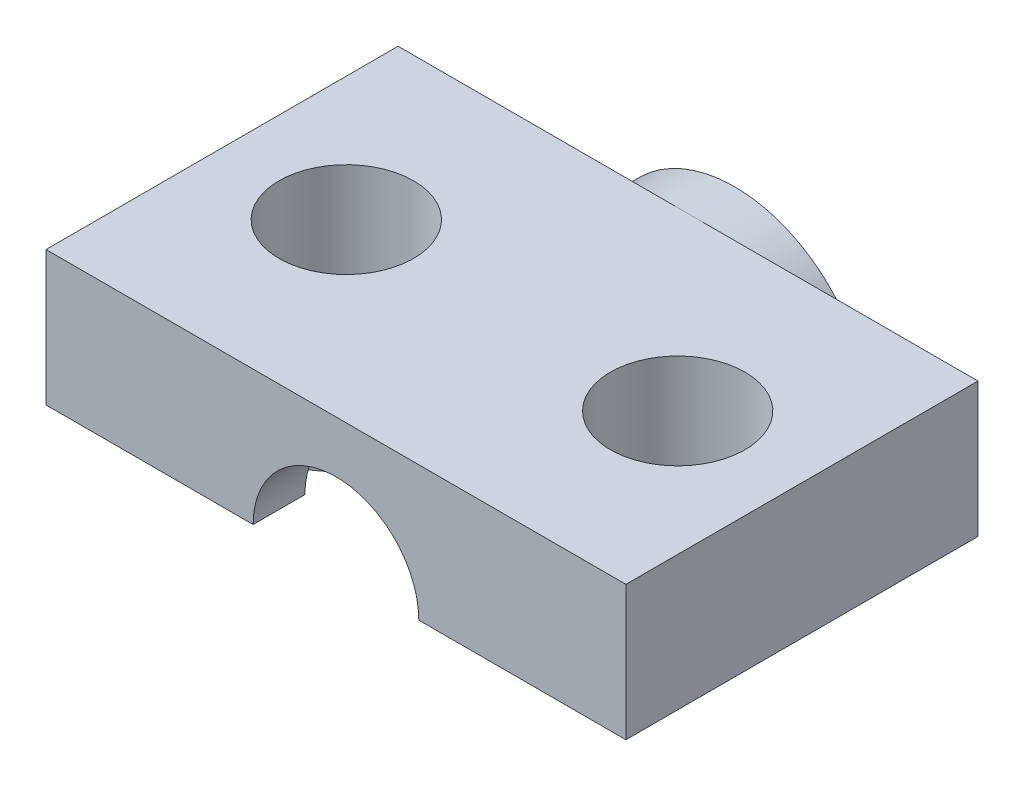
SolidWorks part; units mm, degrees
ref_plane "Front Plane" through (0, 0, 0) normal (0, 0, 1) x (1, 0, 0)
ref_plane "Top Plane" through (0, 0, 0) normal (0, 1, 0) x (1, 0, 0)
ref_plane "Right Plane" through (0, 0, 0) normal (1, 0, 0) x (0, 0, -1)
sketch "Sketch1" plane through (0, 0, 0) normal (0, 1, 0) x (1, 0, 0)
  line L1 (-14, 8.5) -> (14, 8.5)
  line L2 (-14, 8.5) -> (-14, -8.5)
  line L3 (-14, -8.5) -> (14, -8.5)
  line L4 (14, 8.5) -> (14, -8.5)
  line L5 (-14, 8.5) -> (14, -8.5) construction
  line L6 (-14, -8.5) -> (14, 8.5) construction
  point P0 (0, 0)
  dimension "D1" = 28
  dimension "D2" = 17
extrude "Boss-Extrude1" add sketch "Sketch1" along normal blind 6.5
sketch "Sketch3" plane through (0, 0, 0) normal (0, -1, 0) x (1, 0, 0)
  circle A0 centre (-8, 0) radius 3.25
  circle A1 centre (8, 0) radius 3.25
  dimension "D1" = 6.5
  dimension "D2" = 16
  dimension "D3" = 8
extrude "Cut-Extrude1" cut sketch "Sketch3" against normal blind 6.5
shell "Shell1" thickness 2.5
sketch "Sketch5" plane through (0, 4, 0) normal (0, -1, 0) x (1, 0, 0)
  line L1 (-2.3875, 1.25) -> (2.3875, 1.25)
  line L2 (-2.3875, 1.25) -> (-2.3875, -1.25)
  line L3 (-2.3875, -1.25) -> (2.3875, -1.25)
  line L4 (2.3875, 1.25) -> (2.3875, -1.25)
  line L5 (-2.3875, 1.25) -> (2.3875, -1.25) construction
  line L6 (-2.3875, -1.25) -> (2.3875, 1.25) construction
  arc A0 (11.5, 4.5621) -> (11.5, -4.5621) centre (8, 0) ccw construction
  point P0 (0, 0)
  dimension "D1" = 2.5
extrude "Boss-Extrude3" add sketch "Sketch5" along normal up to surface (4 mm away)
sketch "Sketch4" plane through (0, 0, 8.5) normal (0, 0, 1) x (1, 0, 0)
  line L0 (-14, 0) -> (14, 0) construction
  circle A0 centre (0, 0) radius 4
  dimension "D1" = 8
extrude "Cut-Extrude2" cut sketch "Sketch4" against normal through all
sketch "Sketch6" plane through (0, 0, -8.5) normal (0, 0, -1) x (-1, 0, 0)
  line L0 (6.5, 0) -> (4, 0)
  line L1 (-4, 0) -> (-6.5, 0)
  arc A0 (4, 0) -> (-4, 0) centre (0, 0) ccw construction
  arc A1 (4, 0) -> (-4, 0) centre (0, 0) ccw
  arc A2 (6.5, 0) -> (-6.5, 0) centre (0, 0) ccw
  dimension "D1" = 2.5
extrude "Boss-Extrude4" add sketch "Sketch6" along normal blind 2.25
